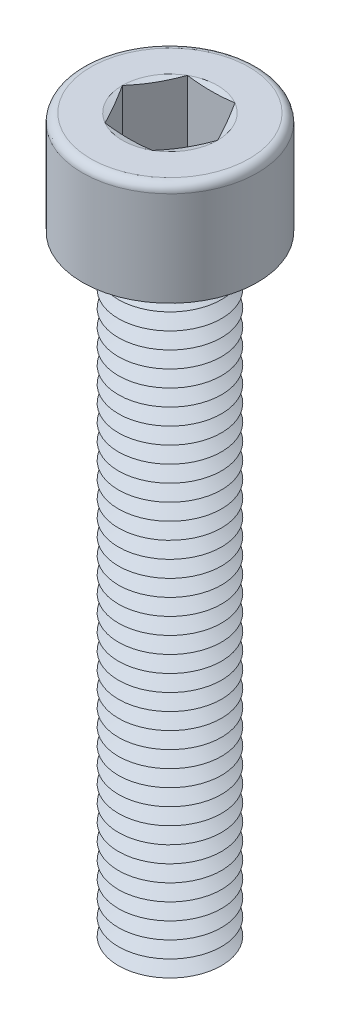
SolidWorks part; units mm, degrees
ref_plane "Front Plane" through (0, 0, 0) normal (0, 0, 1) x (1, 0, 0)
ref_plane "Top Plane" through (0, 0, 0) normal (0, 1, 0) x (1, 0, 0)
ref_plane "Right Plane" through (0, 0, 0) normal (1, 0, 0) x (0, 0, -1)
sketch "Sketch1" plane through (0, 0, 0) normal (0, 1, 0) x (1, 0, 0)
  circle A0 centre (0, 0) radius 2.5
  dimension "D1" = 5
extrude "Extrude1" add sketch "Sketch1" along normal blind 30
sketch "Sketch2" plane through (0, 30, 0) normal (0, 1, 0) x (1, 0, 0)
  circle A0 centre (0, 0) radius 4.25
  dimension "D1" = 8.5
extrude "Extrude2" add sketch "Sketch2" along normal blind 5
sketch "Sketch3" plane through (0, 35, 0) normal (0, 1, 0) x (1, 0, 0)
  line L1 (1.1547, 2) -> (-1.1547, 2)
  line L2 (-1.1547, 2) -> (-2.3094, 0)
  line L3 (-2.3094, 0) -> (-1.1547, -2)
  line L4 (-1.1547, -2) -> (1.1547, -2)
  line L5 (1.1547, -2) -> (2.3094, 0)
  line L6 (2.3094, 0) -> (1.1547, 2)
  circle A0 centre (0, 0) radius 2 construction
  dimension "D1" = 4
extrude "Extrude3" cut sketch "Sketch3" against normal blind 4
fillet "Fillet1" radius 0.4 1 edges at (0, 35, 4.25)
sketch "Sketch4" plane through (0, 0, 0) normal (1, 0, 0) x (0, 0, -1)
  line L0 (-2, 31) -> (0, 31)
  line L1 (0, 31) -> (0, 29.8453)
  line L2 (0, 29.8453) -> (-2, 31)
  dimension "D1" = 30
revolve "Cut-Revolve1" cut sketch "Sketch4" angle 360 about L1
sketch "Sketch5" plane through (0, 0, 0) normal (0, 0, 1) x (1, 0, 0)
  line L0 (-2.5, 0.4) -> (-2.5, -0.4)
  line L1 (-2.5, 30) -> (-2.5, 0) construction
  line L2 (-2.5, -0.4) -> (-1.8072, 0)
  line L3 (-2.5, 0) -> (2.5, 0) construction
  line L4 (-1.8072, 0) -> (-2.5, 0.4)
  dimension "D1" = 0.8
revolve "Cut-Revolve2" cut sketch "Sketch5" angle 360 about axis through (0, 30, 0) along (0, -1, 0)
pattern_linear "LPattern1" count 38 spacing 0.8 along (0, 1, 0) of "Cut-Revolve2"
sketch "Sketch6" plane through (0, 35, 0) normal (0, 1, 0) x (1, 0, 0)
  circle A0 centre (0, 0) radius 2.3094
extrude "Extrude4" cut sketch "Sketch6" against normal through all draft 75
